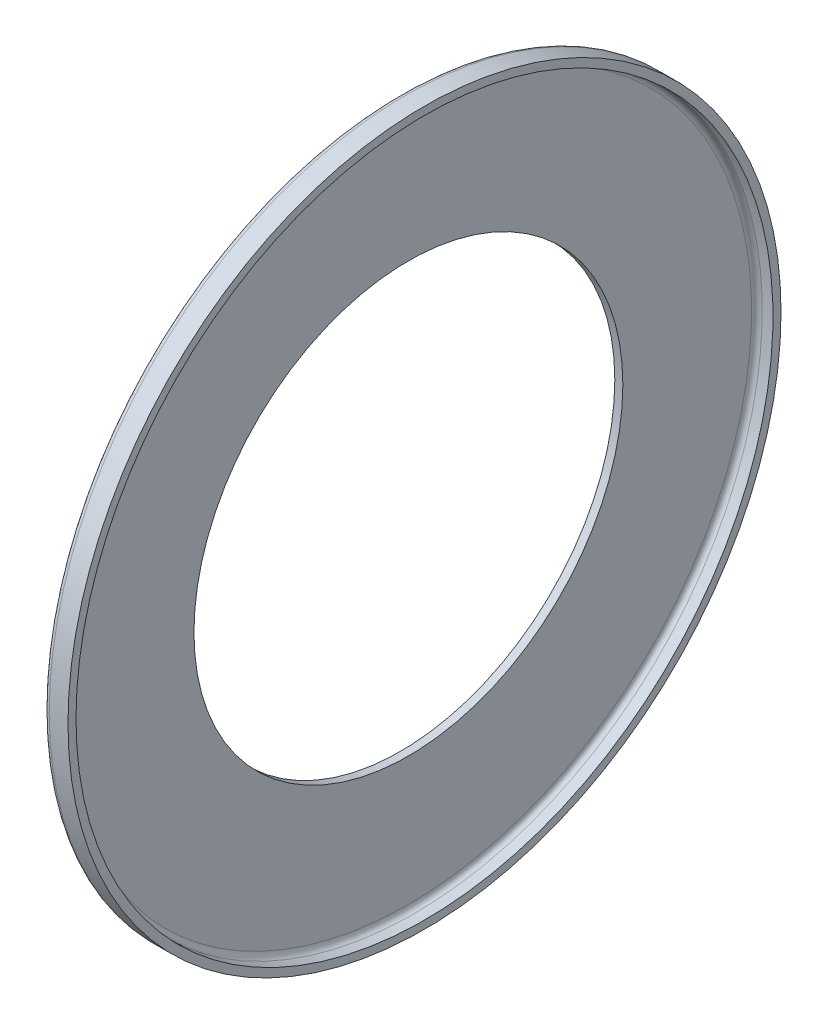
SolidWorks part; units mm, degrees
ref_plane "Plan1" through (0, 0, 0) normal (0, 0, 1) x (1, 0, 0)
ref_plane "Plan2" through (0, 0, 0) normal (0, 1, 0) x (1, 0, 0)
ref_plane "Plan3" through (0, 0, 0) normal (1, 0, 0) x (0, 0, -1)
sketch "Esquisse1" plane through (0, 0, 0) normal (0, 0, 1) x (1, 0, 0)
  line L0 (-100, 0) -> (100, 0) construction
  line L1 (-30, 65.5) -> (-30, 40)
  line L2 (-25.5, 66.5) -> (-25.5, 65)
  line L3 (-27.5, 65) -> (-25.5, 65)
  line L4 (-29, 66.5) -> (-25.5, 66.5)
  line L5 (-30, 40) -> (-28.5, 40)
  line L6 (-28.5, 64) -> (-28.5, 40)
  arc A0 (-29, 66.5) -> (-30, 65.5) centre (-29, 65.5) ccw
  arc A1 (-27.5, 65) -> (-28.5, 64) centre (-27.5, 64) ccw
  dimension "D4" = 1
  dimension "D1" = 65
  dimension "D2" = 1.5
  dimension "D3" = 40
  dimension "D5" = 1.5
revolve "Base-Révolution" add sketch "Esquisse1" angle 360 about L0
